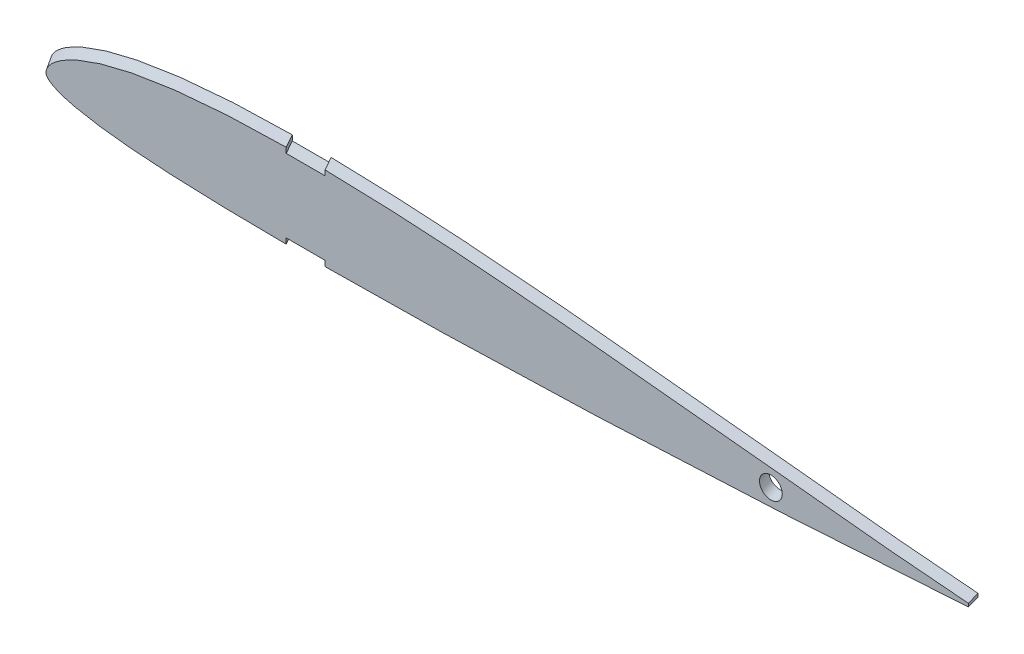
SolidWorks part; units mm, degrees
ref_plane "Front Plane" through (0, 0, 0) normal (0, 0, 1) x (1, 0, 0)
ref_plane "Top Plane" through (0, 0, 0) normal (0, 1, 0) x (1, 0, 0)
ref_plane "Right Plane" through (0, 0, 0) normal (1, 0, 0) x (0, 0, -1)
curve "Curve1"
sketch "Sketch1" plane through (0, 0, 0) normal (0, 0, 1) x (1, 0, 0)
  line L0 (350, 0.1645) -> (350, 0)
  spline S0 degree 3 number of poles 234 (350, 0.1645) -> (350, 0) construction
  spline S1 degree 3 number of poles 234 (350, 0.1645) -> (350, 0)
curve "Curve2"
ref_plane "Plane1" through (0, 0, 601) normal (0, 0, 1) x (1, 0, 0)
sketch "Sketch2" plane through (0, 0, 601) normal (0, 0, 1) x (1, 0, 0)
  line L0 (525.9333, 3.8863) -> (525.9355, 3.8224)
  spline S1 degree 3 number of poles 234 (525.9333, 3.8863) -> (525.9355, 3.8224)
loft "Loft1" add profiles "Sketch1", "Sketch2"
sketch "Sketch3" plane through (0, 0, 0) normal (0, 1, 0) x (1, 0, 0)
  line L0 (342, 25.8692) -> (342, 0)
  line L1 (350.0069, 0) -> (-0.0021, 0) construction
  line L2 (517.9394, -601) -> (517.9394, -608.0397)
  line L3 (-6.6694, -601) -> (6.6694, -601) construction
  line L5 (390.0156, -601) -> (525.9394, -601) construction
  line L6 (390.0156, -601) -> (525.9394, -601)
  line L7 (342, 0) -> (517.9394, -601)
  line L8 (517.9394, -608.0397) -> (557.5572, -596.1903)
  line L9 (557.5572, -596.1903) -> (340.8273, 128.4324)
  line L10 (340.8273, 128.4324) -> (342, 25.8692)
  dimension "D1" = 8
  dimension "D2" = 8
extrude "Cut-Extrude1" cut sketch "Sketch3" against normal through all both and the other way through all
sketch "Sketch4" plane through (0, 0, 0) normal (0, 0, -1) x (-1, 0, 0)
  line L0 (0, 0) -> (-96.25, 0)
  line L1 (-103.405, -8.5887) -> (-89.095, -8.5887)
  line L3 (-103.405, 20.5658) -> (-103.405, 18.5658)
  line L4 (-103.405, 18.5658) -> (-89.095, 18.5658)
  line L5 (-89.095, 20.5658) -> (-89.095, 18.5658)
  line L6 (-103.405, -8.5887) -> (-103.405, -10.5887)
  line L8 (-89.095, -8.5887) -> (-89.095, -10.5887)
  line L10 (-342, 0.5301) -> (-342, -0.6627)
  line L11 (-342, 0.5301) -> (-342, -0.6627)
  line L15 (-103.405, -10.5887) -> (-103.405, -29.2404)
  line L16 (-103.405, -29.2404) -> (-89.095, -29.2404)
  line L17 (-89.095, -29.2404) -> (-89.095, -10.5887)
  line L18 (-103.405, 20.5658) -> (-103.405, 33.9496)
  line L19 (-103.405, 33.9496) -> (-89.095, 33.9496)
  line L20 (-89.095, 33.9496) -> (-89.095, 20.5658)
  spline S3 degree 3 number of poles 213 (-342, -0.6627) -> (-342, 0.5301)
  spline S4 degree 3 number of poles 213 (-342, -0.6627) -> (-342, 0.5301)
  dimension "D1" = 96.25
  dimension "D2" = 14.31
  dimension "D3" = 2
  dimension "D4" = 7.155
  dimension "D5" = 7.155
  dimension "D7" = 14.31
  dimension "D6" = 0
sketch "Sketch5" plane through (0, 0, 601) normal (0, 0, 1) x (1, 0, 0)
  line L0 (420.4388, -1.9505) -> (434.7488, -1.9505)
  line L1 (389.9417, -0.9345) -> (427.5938, 0.3803)
  line L3 (420.4388, 8.4784) -> (420.4388, 6.4784)
  line L4 (420.4388, 6.4784) -> (434.7488, 6.4784)
  line L5 (434.7488, 8.4784) -> (434.7488, 6.4784)
  line L6 (420.4388, -1.9505) -> (420.4388, -3.9505)
  line L8 (434.7488, -1.9505) -> (434.7488, -3.9505)
  line L9 (420.4388, 8.4784) -> (420.4388, 14.3324)
  line L10 (517.9394, 2.9661) -> (517.9394, 4.1187)
  line L11 (517.9394, 2.9661) -> (517.9394, 4.1187)
  line L12 (420.4388, 14.3324) -> (434.7488, 14.3324)
  line L13 (434.7488, 14.3324) -> (434.7488, 8.4784)
  line L14 (420.4388, -3.9505) -> (420.4388, -10.3696)
  line L15 (420.4388, -10.3696) -> (434.7488, -10.3696)
  line L16 (434.7488, -10.3696) -> (434.7488, -3.9505)
  spline S1 degree 3 number of poles 199 (517.9394, 2.9661) -> (517.9394, 4.1187) construction
  spline S2 degree 3 number of poles 199 (517.9394, 4.1187) -> (517.9394, 2.9661)
  spline S3 degree 3 number of poles 199 (517.9394, 4.1187) -> (517.9394, 2.9661)
  dimension "D1" = 14.31
  dimension "D2" = 37.675
  dimension "D3" = 2
  dimension "D4" = 7.155
  dimension "D5" = 14.31
  dimension "D6" = 2
  dimension "D7" = 7.155
  dimension "D8" = 0
loft "Cut-Loft1" cut
sketch "Sketch6" plane through (0, 0, 601) normal (0, 0, 1) x (1, 0, 0)
  line L0 (389.9417, -0.9345) -> (427.5938, 0.3803) construction
  line L1 (517.9394, 2.9661) -> (517.9394, 4.1187)
  line L2 (517.9394, 2.9661) -> (517.9394, 4.1187)
  line L3 (389.9417, -0.9345) -> (427.5938, 0.3803)
  line L8 (420.4388, -10.3696) -> (434.7488, -10.3696)
  line L9 (434.7488, -10.3696) -> (434.7488, -3.9505)
  line L10 (434.7488, -3.9505) -> (434.7488, -1.9505)
  line L11 (434.7488, -1.9505) -> (420.4388, -1.9505)
  line L12 (420.4388, -1.9505) -> (420.4388, -3.9505)
  line L13 (420.4388, -3.9505) -> (420.4388, -10.3696)
  line L14 (420.4388, -10.3696) -> (434.7488, -10.3696)
  line L15 (434.7488, -10.3696) -> (434.7488, -3.9505)
  line L16 (434.7488, -3.9505) -> (434.7488, -1.9505)
  line L17 (434.7488, -1.9505) -> (420.4388, -1.9505)
  line L18 (420.4388, -1.9505) -> (420.4388, -3.9505)
  line L19 (420.4388, -3.9505) -> (420.4388, -10.3696)
  line L20 (434.7488, 14.3324) -> (420.4388, 14.3324)
  line L21 (434.7488, 8.4784) -> (434.7488, 14.3324)
  line L22 (434.7488, 6.4784) -> (434.7488, 8.4784)
  line L23 (420.4388, 6.4784) -> (434.7488, 6.4784)
  line L24 (420.4388, 8.4784) -> (420.4388, 6.4784)
  line L25 (420.4388, 14.3324) -> (420.4388, 8.4784)
  line L26 (434.7488, 14.3324) -> (420.4388, 14.3324)
  line L27 (434.7488, 8.4784) -> (434.7488, 14.3324)
  line L28 (434.7488, 6.4784) -> (434.7488, 8.4784)
  line L29 (420.4388, 6.4784) -> (434.7488, 6.4784)
  line L30 (420.4388, 8.4784) -> (420.4388, 6.4784)
  line L31 (420.4388, 14.3324) -> (420.4388, 8.4784)
  spline S1 degree 3 number of poles 199 (517.9394, 4.1187) -> (517.9394, 2.9661)
  spline S2 degree 3 number of poles 199 (517.9394, 4.1187) -> (517.9394, 2.9661)
  dimension "D1" = 0
  dimension "D2" = 0
  dimension "D3" = 0
sketch "Sketch7" plane through (0, 0, 0) normal (0, 0, -1) x (-1, 0, 0)
  line L0 (0, 0) -> (-96.25, 0) construction
  line L1 (-342, 0.5301) -> (-342, -0.6627)
  line L2 (-342, 0.5301) -> (-342, -0.6627)
  line L3 (0, 0) -> (-96.25, 0)
  line L8 (-89.095, -8.5887) -> (-103.405, -8.5887)
  line L9 (-89.095, -10.5887) -> (-89.095, -8.5887)
  line L10 (-89.095, -29.2404) -> (-89.095, -10.5887)
  line L11 (-103.405, -29.2404) -> (-89.095, -29.2404)
  line L12 (-103.405, -10.5887) -> (-103.405, -29.2404)
  line L13 (-103.405, -8.5887) -> (-103.405, -10.5887)
  line L14 (-89.095, -8.5887) -> (-103.405, -8.5887)
  line L15 (-89.095, -10.5887) -> (-89.095, -8.5887)
  line L16 (-89.095, -29.2404) -> (-89.095, -10.5887)
  line L17 (-103.405, -29.2404) -> (-89.095, -29.2404)
  line L18 (-103.405, -10.5887) -> (-103.405, -29.2404)
  line L19 (-103.405, -8.5887) -> (-103.405, -10.5887)
  line L20 (-89.095, 33.9496) -> (-103.405, 33.9496)
  line L21 (-89.095, 20.5658) -> (-89.095, 33.9496)
  line L22 (-89.095, 18.5658) -> (-89.095, 20.5658)
  line L23 (-103.405, 18.5658) -> (-89.095, 18.5658)
  line L24 (-103.405, 20.5658) -> (-103.405, 18.5658)
  line L25 (-103.405, 33.9496) -> (-103.405, 20.5658)
  line L26 (-89.095, 33.9496) -> (-103.405, 33.9496)
  line L27 (-89.095, 20.5658) -> (-89.095, 33.9496)
  line L28 (-89.095, 18.5658) -> (-89.095, 20.5658)
  line L29 (-103.405, 18.5658) -> (-89.095, 18.5658)
  line L30 (-103.405, 20.5658) -> (-103.405, 18.5658)
  line L31 (-103.405, 33.9496) -> (-103.405, 20.5658)
  spline S1 degree 3 number of poles 213 (-342, -0.6627) -> (-342, 0.5301)
  spline S2 degree 3 number of poles 213 (-342, -0.6627) -> (-342, 0.5301)
  dimension "D1" = 0
  dimension "D2" = 0
  dimension "D3" = 0
loft "Cut-Loft2" cut
sketch "Sketch8" plane through (0, 0, 0) normal (0, 1, 0) x (1, 0, 0)
  line L0 (-55.6253, -5) -> (438.4371, -5)
  line L4 (89.095, 0) -> (-0.0021, 0) construction
  line L10 (-55.6253, -5) -> (320.2237, -643.244)
  line L11 (320.2237, -643.244) -> (745.2795, -619.0504)
  line L12 (745.2795, -619.0504) -> (438.4371, -5)
  dimension "D1" = 5
extrude "Cut-Extrude4" cut sketch "Sketch8" against normal through all both and the other way through all
other "Cavity1"
other "os<1>@skrzydlo1"
